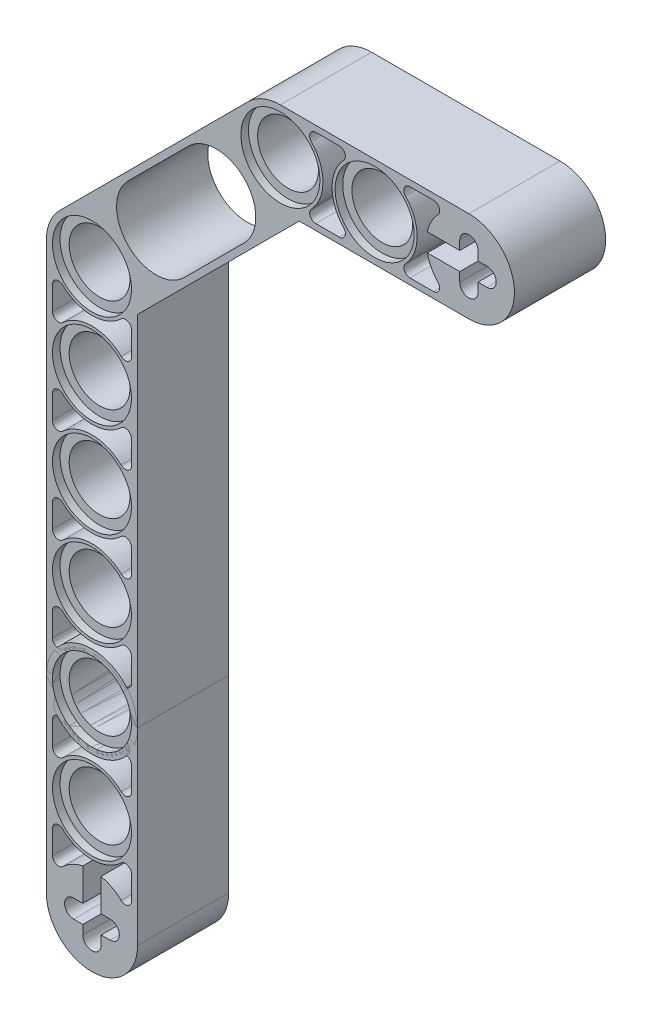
SolidWorks part; units mm, degrees
other "<LTemplate>-<Mirror1>"
other "<Three_Straight>-<Mirror3>"
other "<Five_Straight>-<Mirror3>"
other "<LTemplate>-<Mirror1>"
ref_plane "Front Plane" through (0, 0, 0) normal (0, 0, 1) x (1, 0, 0)
ref_plane "Top Plane" through (0, 0, 0) normal (0, 1, 0) x (1, 0, 0)
ref_plane "Right Plane" through (0, 0, 0) normal (1, 0, 0) x (0, 0, -1)
ref_plane "Front Plane-LTemplate" through (0, 0, 0) normal (0, 0, 1) x (1, 0, 0)
ref_plane "Top Plane-LTemplate" through (0, 0, 0) normal (0, 1, 0) x (1, 0, 0)
ref_plane "Right Plane-LTemplate" through (0, 0, 0) normal (1, 0, 0) x (0, 0, -1)
ref_plane "Plane2-LTemplate" through (11.684, 0, 0) normal (1, 0, 0) x (0, 0, -1)
ref_plane "Plane3-LTemplate" through (0, 0, 0) normal (0, 1, 0) x (-1, 0, 0)
inserted part "LTemplate"
ref_plane "Front Plane-Three_Straight" through (-14.1812, -3.1064, 11.4986) normal (0, 0, 1) x (1, 0, 0)
ref_plane "Top Plane-Three_Straight" through (-14.1812, -3.1064, 11.4986) normal (0, 1, 0) x (1, 0, 0)
ref_plane "Right Plane-Three_Straight" through (-14.1812, -3.1064, 11.4986) normal (1, 0, 0) x (0, 0, -1)
ref_plane "Plane2-Three_Straight" through (-2.4972, -3.1064, 11.4986) normal (1, 0, 0) x (0, 0, -1)
ref_plane "Plane1-Three_Straight" through (-14.1812, -3.1064, 11.4986) normal (1, 0, 0) x (0, 0, -1)
ref_plane "Plane3-Three_Straight" through (-14.1812, -3.1064, 15.3086) normal (0, 0, 1) x (1, 0, 0)
ref_plane "Plane4-Three_Straight" through (-25.8652, -3.1064, 11.4986) normal (-1, 0, 0) x (0, 0, 1)
inserted part "Three_Straight"
move or copy body "Body-Move/Copy1" bodies to move or copy 102 placed by mates yes
other "Angle1" parameters "D1"=315
ref_plane "Front Plane-Five_Straight" through (-28.0282, -21.1541, 2.9269) normal (0, 0, 1) x (1, 0, 0)
ref_plane "Top Plane-Five_Straight" through (-28.0282, -21.1541, 2.9269) normal (0, 1, 0) x (1, 0, 0)
ref_plane "Right Plane-Five_Straight" through (-28.0282, -21.1541, 2.9269) normal (1, 0, 0) x (0, 0, -1)
ref_plane "Plane2-Five_Straight" through (-16.3442, -21.1541, 2.9269) normal (1, 0, 0) x (0, 0, -1)
ref_plane "Plane1-Five_Straight" through (-35.9022, -21.1541, 2.9269) normal (1, 0, 0) x (0, 0, -1)
ref_plane "Plane3-Five_Straight" through (-28.0282, -21.1541, 6.7369) normal (0, 0, 1) x (1, 0, 0)
ref_plane "Plane4-Five_Straight" through (-55.4602, -21.1541, 2.9269) normal (-1, 0, 0) x (0, 0, 1)
inserted part "Five_Straight"
move or copy body "Body-Move/Copy2" bodies to move or copy 104 placed by mates yes
other "Angle2" parameters "D1"=45
sketch "Sketch1" plane through (0, 0, 7.62) normal (0, 0, 1) x (1, 0, 0)
  line L0 (-7.874, 0) -> (-7.874, -23.622)
  line L1 (-7.874, -23.622) -> (-23.622, -23.622)
  line L2 (-23.622, -10.4919) -> (-23.622, -34.359)
  line L3 (-27.432, -10.4919) -> (-27.432, -34.359)
  dimension "D1" = 15.748
  dimension "D2" = 23.622
  dimension "D3" = 3.81
move or copy body "Body-Move/Copy3" bodies to move or copy 105 placed by mates yes
move or copy body "Body-Move/Copy4" bodies to move or copy 106 placed by mates yes
other "Distance2" parameters "D1"=7.874
ref_plane "Front Plane-LTemplate1" through (-37.3883, -51.0788, 7.6543) normal (0, 0, 1) x (1, 0, 0)
ref_plane "Top Plane-LTemplate1" through (-37.3883, -51.0788, 7.6543) normal (0, 1, 0) x (1, 0, 0)
ref_plane "Right Plane-LTemplate1" through (-37.3883, -51.0788, 7.6543) normal (1, 0, 0) x (0, 0, -1)
ref_plane "Plane2-LTemplate1" through (-25.7043, -51.0788, 7.6543) normal (1, 0, 0) x (0, 0, -1)
ref_plane "Plane3-LTemplate1" through (-37.3883, -51.0788, 7.6543) normal (0, 1, 0) x (-1, 0, 0)
inserted part "LTemplate1"
move or copy body "Body-Move/Copy5" bodies to move or copy 108 placed by mates yes
delete or keep bodies "Body-Delete1" type delete bodies bodies 103
sketch "Sketch2" plane through (0, 0, 7.62) normal (0, 0, 1) x (1, 0, 0)
  line L0 (-26.3161, -13.0539) -> (-10.5681, 2.6941)
  line L1 (-19.812, -17.3262) -> (-6.2958, -3.81)
  line L2 (7.874, -3.81) -> (-7.874, -3.81) construction
  line L3 (-6.2958, -3.81) -> (-7.874, -3.81)
  line L4 (-19.812, -15.748) -> (-19.812, -47.244) construction
  line L5 (-18.2625, -10.3885) -> (-13.2335, -5.3595) construction
  line L6 (-19.812, -15.748) -> (-19.812, -17.3262)
  line L7 (-20.5973, -8.0536) -> (-15.5684, -3.0247)
  line L8 (-15.9276, -12.7233) -> (-10.8987, -7.6944)
  line L9 (-18.4421, -5.1799) -> (-13.0539, -10.5681) construction
  arc A0 (-19.812, -15.748) -> (-27.432, -15.748) centre (-23.622, -15.748) ccw construction
  arc A1 (-19.812, -15.748) -> (-26.3161, -13.0539) centre (-23.622, -15.748) ccw
  arc A2 (-7.874, 3.81) -> (-7.874, -3.81) centre (-7.874, 0) ccw construction
  arc A3 (-10.5681, 2.6941) -> (-7.874, -3.81) centre (-7.874, 0) ccw
  arc A4 (-20.5973, -8.0536) -> (-15.9276, -12.7233) centre (-18.2625, -10.3885) ccw
  arc A5 (-10.8987, -7.6944) -> (-15.5684, -3.0247) centre (-13.2335, -5.3595) ccw
  point P8 (-20.9279, -18.4421)
  point P9 (-5.1799, -2.6941)
  point P16 (-15.748, -7.874)
  dimension "D4" = 7.112
  dimension "D1" = 7.62
  dimension "D2" = 0.508
extrude "Boss-Extrude1" add sketch "Sketch2" against normal blind 7.62
